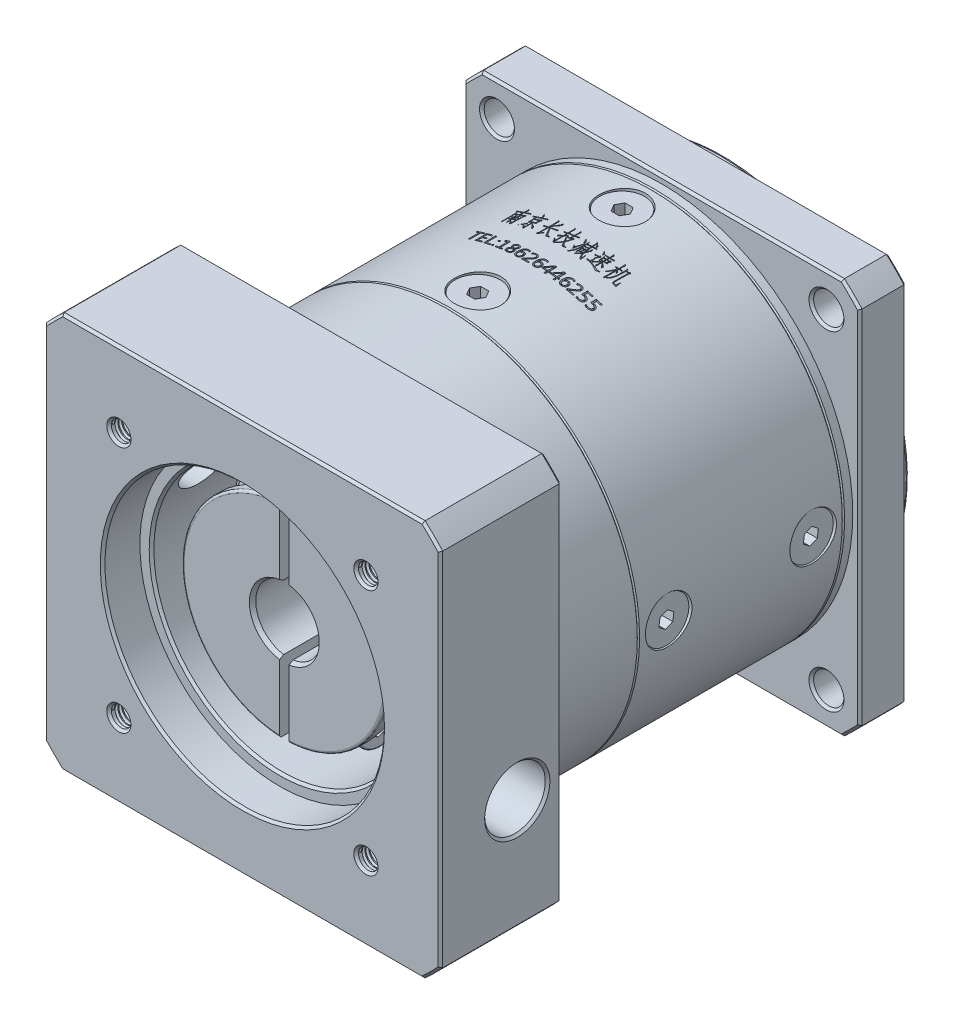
SolidWorks part; units mm, degrees
ref_plane "前视基准面" through (0, 0, 0) normal (0, 0, 1) x (1, 0, 0)
ref_plane "上视基准面" through (0, 0, 0) normal (0, 1, 0) x (1, 0, 0)
ref_plane "右视基准面" through (0, 0, 0) normal (1, 0, 0) x (0, 0, -1)
imported_body "14-60-75-M5-1-solid1"
imported_body "14-60-75-M5-1-solid2"
imported_body "14-60-75-M5-1-solid3"
imported_body "14-60-75-M5-1-solid4"
imported_body "ZF80-K15-L1-2-solid1"
imported_body "ZF80-K15-L1-2-solid2"
imported_body "ZF80-K15-L1-2-solid3"
imported_body "ZF80-K15-L1-2-solid4"
imported_body "ZF80-K15-L1-2-solid5"
imported_body "ZF80-K15-L1-2-solid6"
imported_body "ZF80-K15-L1-2-solid7"
imported_body "ZF80-K15-L1-2-solid8"
imported_body "ZF80-K15-L1-2-solid9"
sketch "草图1" plane through (0, 0, -43.4716) normal (0, 0, -1) x (-1, 0, 0)
  circle A0 centre (53.087, 49.8397) radius 10.9754
  dimension "D1" = 21.9507
extrude "凸台-拉伸1" add sketch "草图1" along normal blind 5
